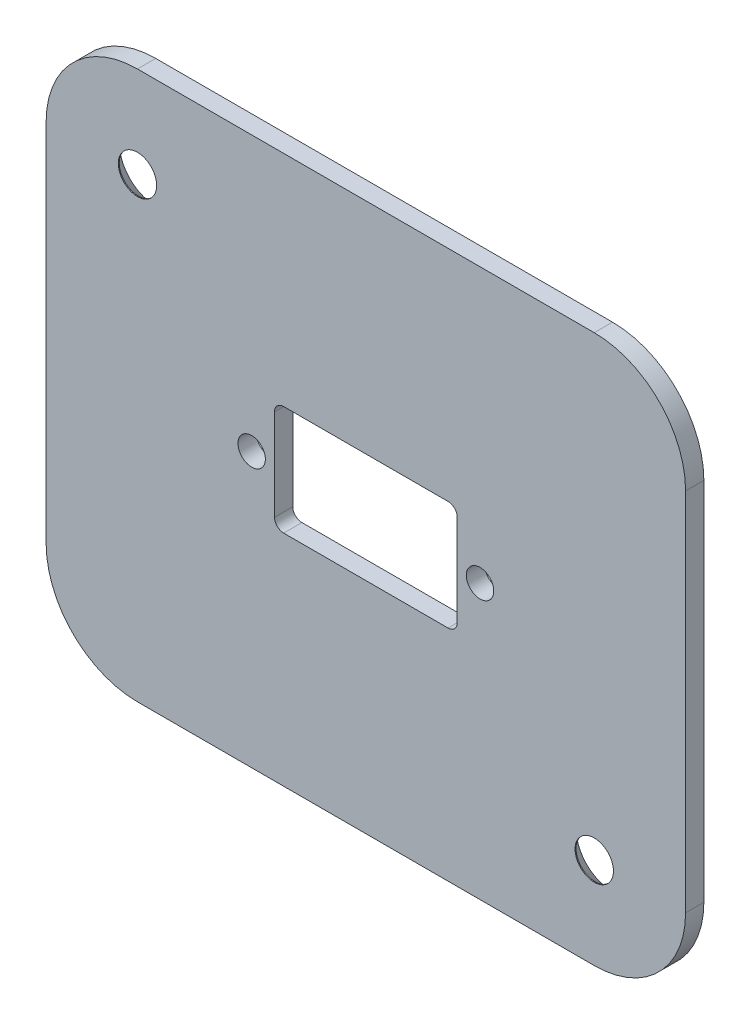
SolidWorks part; units mm, degrees
ref_plane "Plan de face" through (0, 0, 0) normal (0, 0, 1) x (1, 0, 0)
ref_plane "Plan de dessus" through (0, 0, 0) normal (0, 1, 0) x (1, 0, 0)
ref_plane "Plan de droite" through (0, 0, 0) normal (1, 0, 0) x (0, 0, -1)
sketch "Esquisse1" plane through (0, 0, 0) normal (0, 0, 1) x (1, 0, 0)
  line L1 (0, 0) -> (70, 0)
  line L2 (0, 0) -> (0, 60)
  line L3 (0, 60) -> (70, 60)
  line L4 (70, 0) -> (70, 60)
  dimension "D1" = 70
  dimension "D2" = 60
extrude "Boss.-Extru.1" add sketch "Esquisse1" against normal blind 2
fillet "Congé1" radius 10 4 edges at (70, 0, -1) (0, 0, -1) (0, 60, -1) (70, 60, -1)
sketch "Esquisse2" plane through (0, 0, 0) normal (0, 0, 1) x (1, 0, 0)
  line L0 (-9.6552, 50) -> (75.5928, 50) construction
  line L1 (-10.7481, 10) -> (82.5602, 10) construction
  line L2 (10, 73.7307) -> (10, -2.5007) construction
  line L3 (60, 73.7307) -> (60, -3.457) construction
  line L4 (60, 60) -> (10, 60) construction
  line L5 (0, 50) -> (0, 10) construction
  line L6 (10, 0) -> (60, 0) construction
  line L7 (70, 10) -> (70, 50) construction
  circle A0 centre (10, 50) radius 2.1
  circle A1 centre (60, 10) radius 2.1
  point P10 (0, 30)
  dimension "D5" = 4.2
  dimension "D6" = 4.2
  dimension "D1" = 10
  dimension "D2" = 10
  dimension "D3" = 10
  dimension "D4" = 10
extrude "Enlèv. mat.-Extru.1" cut sketch "Esquisse2" against normal through all
chamfer "Chanfrein1" distance 1.9 angle 45 2 edges at (12.1, 50, -2) (62.1, 10, -2)
sketch "Esquisse3" plane through (0, 0, -2) normal (0, 0, -1) x (-1, 0, 0)
  line L0 (-60, 60) -> (-10, 60) construction
  line L1 (-44, 36) -> (-26, 36)
  line L2 (-45, 35) -> (-45, 25)
  line L3 (-44, 24) -> (-26, 24)
  line L4 (-25, 35) -> (-25, 25)
  line L7 (-70, 10) -> (-70, 50) construction
  circle A0 centre (-22.5, 30) radius 1.5
  circle A1 centre (-47.5, 30) radius 1.5
  arc A2 (-45, 25) -> (-44, 24) centre (-44, 25) ccw
  arc A3 (-26, 24) -> (-25, 25) centre (-26, 25) ccw
  arc A4 (-25, 35) -> (-26, 36) centre (-26, 35) ccw
  arc A5 (-44, 36) -> (-45, 35) centre (-44, 35) ccw
  dimension "D5" = 25
  dimension "D6" = 3
  dimension "D7" = 3
  dimension "D11" = 1
  dimension "D1" = 20
  dimension "D2" = 12
  dimension "D3" = 24
  dimension "D4" = 25
  dimension "D8" = 6
  dimension "D9" = 2.5
  dimension "D10" = 6
extrude "Enlèv. mat.-Extru.2" cut sketch "Esquisse3" against normal through all
sketch "Esquisse4" plane through (0, 0, -2) normal (0, 0, -1) x (-1, 0, 0)
  text T0 "59 VC"
extrude "Enlèv. mat.-Extru.3" cut sketch "Esquisse4" against normal blind 1
